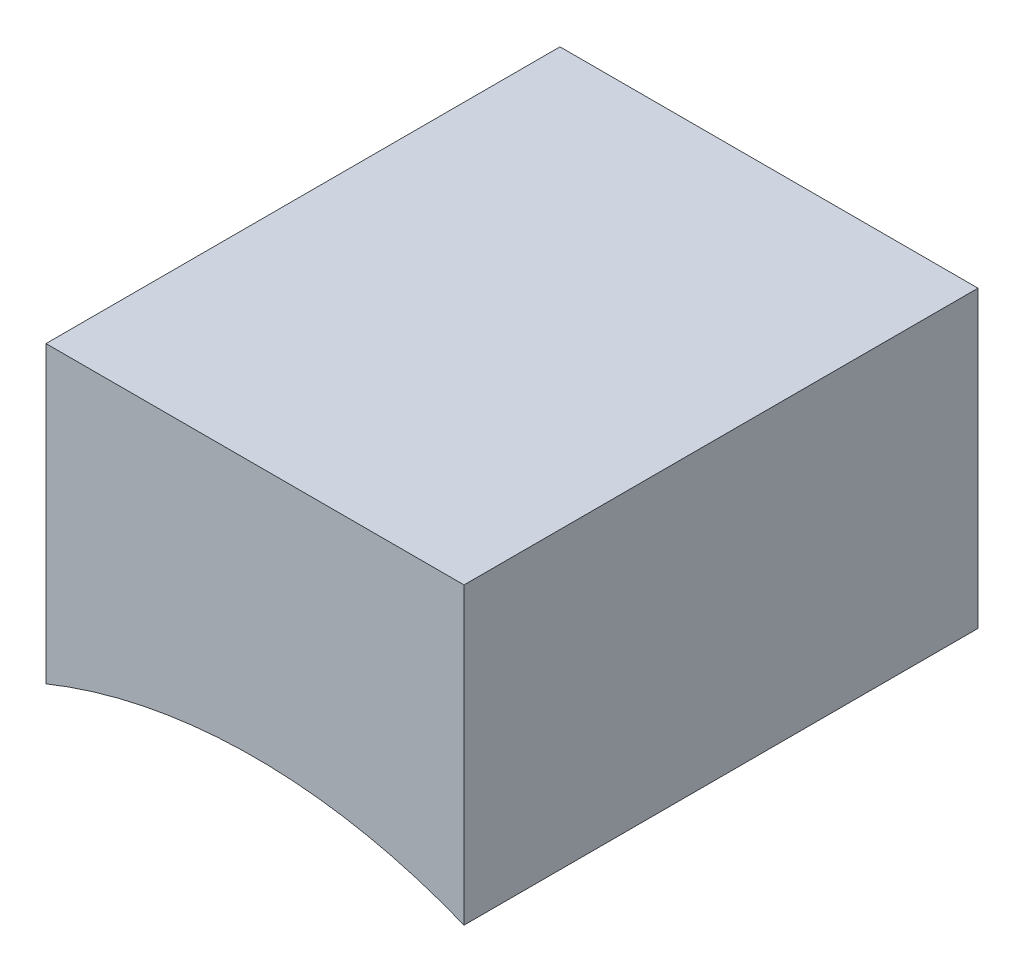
SolidWorks part; units mm, degrees
ref_plane "Front Plane" through (0, 0, 0) normal (0, 0, 1) x (1, 0, 0)
ref_plane "Top Plane" through (0, 0, 0) normal (0, 1, 0) x (1, 0, 0)
ref_plane "Right Plane" through (0, 0, 0) normal (1, 0, 0) x (0, 0, -1)
sketch "Sketch1" plane through (0, 0, 0) normal (0, 0, 1) x (1, 0, 0)
  line L1 (7.747, 19.142) -> (7.747, 30.064)
  line L2 (7.747, 30.064) -> (-7.747, 30.064)
  line L3 (-7.747, 30.064) -> (-7.747, 19.142)
  arc A0 (7.747, 19.142) -> (-7.747, 19.142) centre (0, 0) ccw
  dimension "D1" = 20.6502
  dimension "D2" = 10.922
extrude "Extrude1" add sketch "Sketch1" along normal blind 19.05
